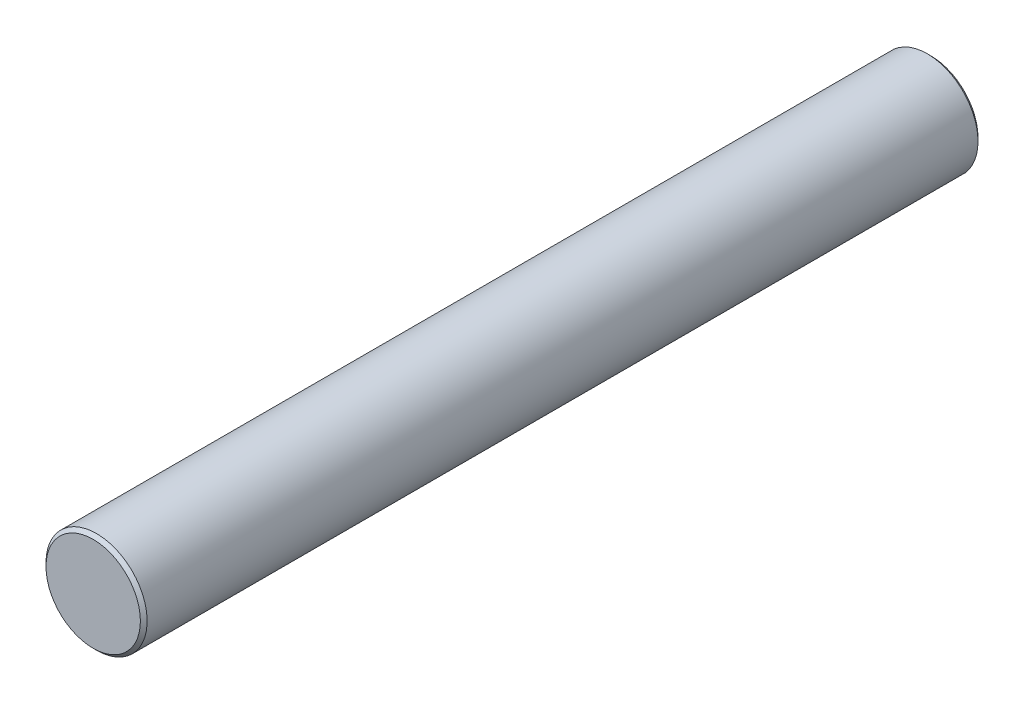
SolidWorks part; units mm, degrees
ref_plane "前视基准面" through (0, 0, 0) normal (0, 0, 1) x (1, 0, 0)
ref_plane "上视基准面" through (0, 0, 0) normal (0, 1, 0) x (1, 0, 0)
ref_plane "右视基准面" through (0, 0, 0) normal (1, 0, 0) x (0, 0, -1)
sketch "草图1" plane through (0, 0, 0) normal (0, 0, 1) x (1, 0, 0)
  circle A0 centre (0, 0) radius 30
extrude "凸台-拉伸1" add sketch "草图1" along normal blind 497
hole_wizard "M16 螺纹孔1" positions "草图2" profile "草图3" tap size "M16" standard "ISO"
sketch "草图2" plane through (0, 0, 0) normal (0, 0, -1) x (-1, 0, 0)
  point P0 (0, 0)
sketch "草图3" plane through (0, 0, 0) normal (1, 0, 0) x (0, 1, 0)
  line L0 (0, 0) -> (0, 42.206)
  line L1 (0, 42.206) -> (7, 38)
  line L2 (7, 38) -> (7, 0)
  line L5 (7, 0) -> (0, 0)
  line L10 (0, 42.206) -> (-7, 38) construction
  line L11 (0, -6.35) -> (0, 107.95) construction
  dimension "螺纹孔钻头直径" = 14
  dimension "螺纹孔钻头深度" = 38
  dimension "导头角度" = 118
chamfer "倒角1" distance 2 angle 45 2 edges at (30, 0, 497) (30, 0, 0)
